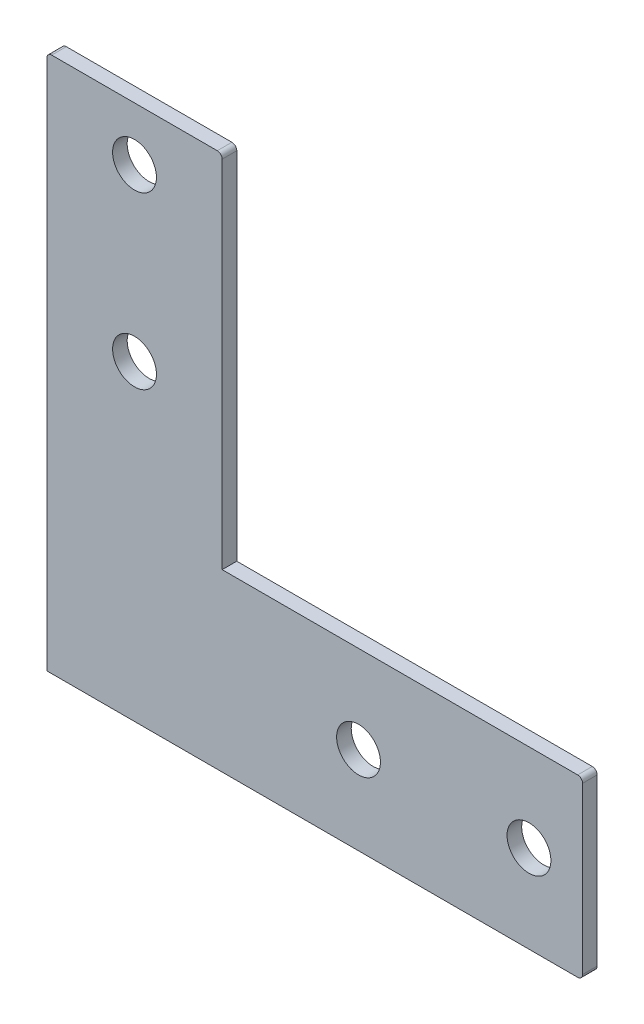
SolidWorks part; units mm, degrees
ref_plane "前视基准面" through (0, 0, 0) normal (0, 0, 1) x (1, 0, 0)
ref_plane "上视基准面" through (0, 0, 0) normal (0, 1, 0) x (1, 0, 0)
ref_plane "右视基准面" through (0, 0, 0) normal (1, 0, 0) x (0, 0, -1)
sketch "草图1" plane through (0, 0, 0) normal (0, 0, 1) x (1, 0, 0)
  line L0 (0, 0) -> (0, 110)
  line L1 (0, 110) -> (36, 110)
  line L2 (36, 110) -> (36, 36)
  line L3 (36, 36) -> (110, 36)
  line L4 (110, 36) -> (110, 0)
  line L5 (110, 0) -> (0, 0)
  line L6 (36, 36) -> (0, 0) construction
  circle A0 centre (18, 99) radius 4.5
  circle A1 centre (18, 64) radius 4.5
  circle A2 centre (99, 18) radius 4.5
  circle A3 centre (64, 18) radius 4.5
  dimension "D5" = 11
  dimension "D6" = 35
  dimension "D1" = 110
  dimension "D2" = 110
  dimension "D3" = 36
  dimension "D4" = 36
extrude "凸台-拉伸1" add sketch "草图1" along normal mid plane 3
fillet "圆角1" radius 1 4 edges at (110, 0, 0) (110, 36, 0) (0, 110, 0) (36, 110, 0)
